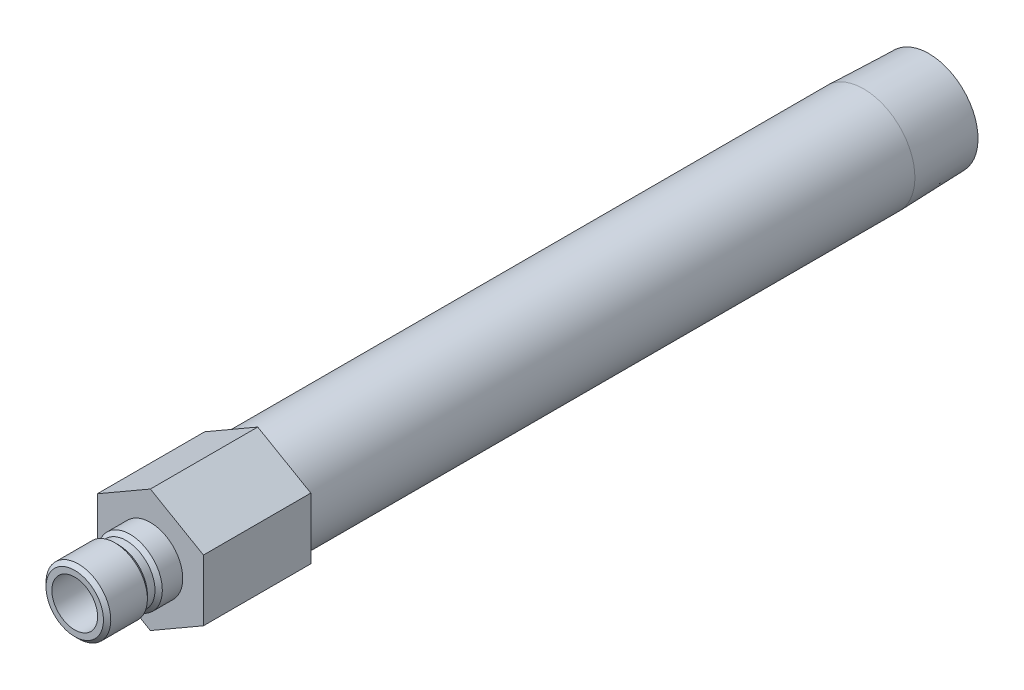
SolidWorks part; units mm, degrees
ref_plane "Front Plane" through (0, 0, 0) normal (0, 0, 1) x (1, 0, 0)
ref_plane "Top Plane" through (0, 0, 0) normal (0, 1, 0) x (1, 0, 0)
ref_plane "Right Plane" through (0, 0, 0) normal (1, 0, 0) x (0, 0, -1)
sketch "Sketch1" plane through (0, 0, 0) normal (1, 0, 0) x (0, 0, -1)
  line L0 (0, 0) -> (-18.923, 0) construction
  line L1 (-15.748, 4.7625) -> (-15.748, 5.9817)
  line L2 (-6.604, 5.9817) -> (-6.604, 0) construction
  line L3 (-14.986, 6.7437) -> (-7.366, 6.7437)
  line L4 (0, 10.668) -> (0, 0) construction
  line L5 (-6.604, 5.9817) -> (-5.0165, 5.9817)
  line L6 (-4.2545, 6.7437) -> (0, 6.7437)
  line L7 (0, 6.7437) -> (0, 10.668)
  line L8 (-6.604, 5.9817) -> (-7.366, 6.7437)
  line L9 (-5.0165, 5.9817) -> (-4.2545, 6.7437)
  line L10 (-15.748, 5.9817) -> (-14.986, 6.7437)
  line L11 (-15.748, 4.7625) -> (22.352, 4.7625)
  line L12 (0, 10.668) -> (148.4884, 10.668)
  line L13 (148.4884, 10.668) -> (162.052, 10.2441)
  line L14 (162.052, 10.2441) -> (162.052, 7.8994)
  line L15 (0, 6.7437) -> (22.352, 6.7437) construction
  line L16 (22.352, 6.7437) -> (22.352, 0) construction
  line L17 (22.352, 0) -> (0, 0) construction
  line L18 (22.352, 4.7625) -> (22.352, 7.8994)
  line L19 (22.352, 7.8994) -> (162.052, 7.8994)
  dimension "D1" = 15.748
  dimension "D2" = 1.5875
  dimension "D3" = 0.762
  dimension "D4" = 45
  dimension "D5" = 9.144
  dimension "D6" = 45
  dimension "D7" = 1.79
  dimension "D8" = 13.5636
  dimension "D9" = 177.8
  dimension "D10" = 3.175
  dimension "D11" = 9.525
  dimension "D12" = 21.336
  dimension "D13" = 38.1
  dimension "D14" = 13.4874
  dimension "D15" = 15.7988
revolve "Revolve1" add sketch "Sketch1" angle 360 about L0
sketch "Sketch2" plane through (0, 0, 0) normal (0, 0, 1) x (1, 0, 0)
  line L1 (-11.049, 6.3791) -> (-11.049, -6.3791)
  line L2 (-11.049, -6.3791) -> (0, -12.7583)
  line L3 (0, -12.7583) -> (11.049, -6.3791)
  line L4 (11.049, -6.3791) -> (11.049, 6.3791)
  line L5 (11.049, 6.3791) -> (0, 12.7583)
  line L6 (0, 12.7583) -> (-11.049, 6.3791)
  circle A0 centre (0, 0) radius 11.049 construction
  circle A1 centre (0, 0) radius 4.7625 construction
  circle A2 centre (0, 0) radius 4.7625
  dimension "D1" = 22.098
extrude "Boss-Extrude1" add sketch "Sketch2" against normal up to vertex (22.352 mm away) from vertex at 0
